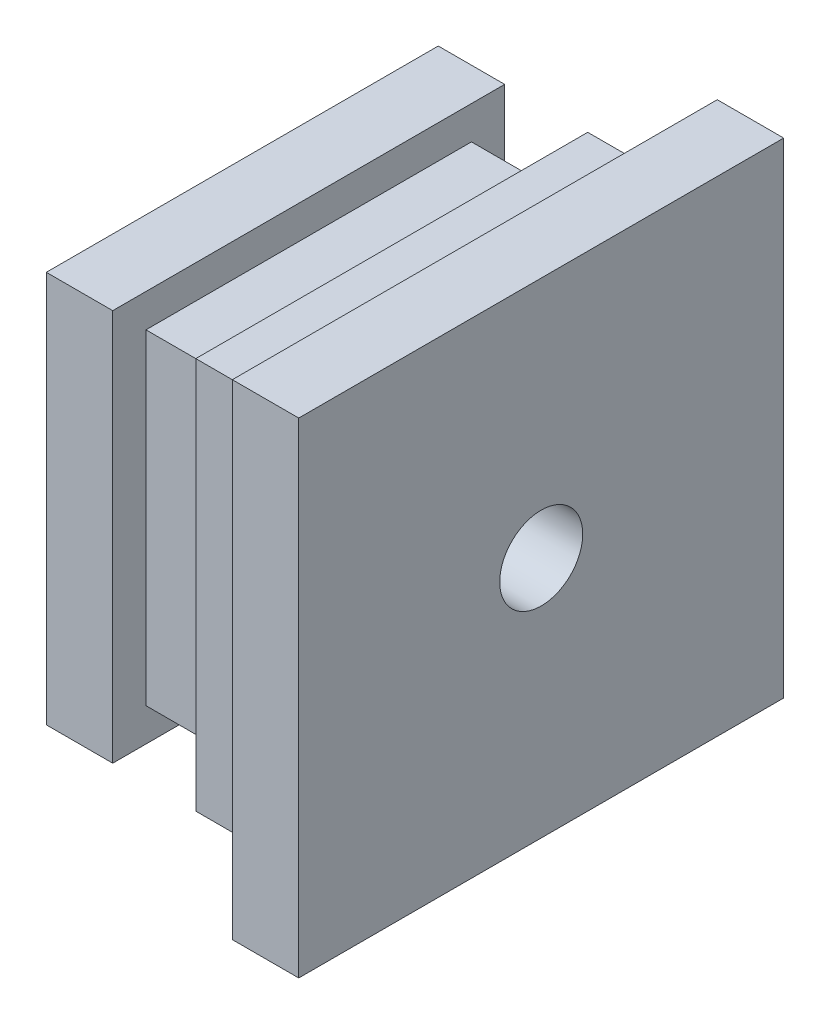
SolidWorks part; units mm, degrees
ref_plane "Спереди" through (0, 0, 0) normal (0, 0, 1) x (1, 0, 0)
ref_plane "Сверху" through (0, 0, 0) normal (0, 1, 0) x (1, 0, 0)
ref_plane "Справа" through (0, 0, 0) normal (1, 0, 0) x (0, 0, -1)
other "Configuration Table"
sketch "Эскиз1" plane through (0, 0, 0) normal (1, 0, 0) x (0, 0, -1)
  line L1 (-11.9614, 4.6852) -> (-0.1614, 4.6852)
  line L2 (-11.9614, 4.6852) -> (-11.9614, -7.1148)
  line L3 (-11.9614, -7.1148) -> (-0.1614, -7.1148)
  line L4 (-0.1614, 4.6852) -> (-0.1614, -7.1148)
  dimension "D1" = 11.8
  dimension "D2" = 11.8
extrude "Бобышка-Вытянуть1" add sketch "Эскиз1" along normal blind 8
sketch "Эскиз2" plane through (8, 0, 0) normal (1, 0, 0) x (0, 0, -1)
  line L0 (-13.3614, 6.0852) -> (-13.3614, -8.5148)
  line L1 (-13.3614, -8.5148) -> (1.2386, -8.5148)
  line L2 (1.2386, -8.5148) -> (1.2386, 6.0852)
  line L3 (1.2386, 6.0852) -> (-13.3614, 6.0852)
  line L4 (-11.9614, 4.6852) -> (-11.9614, -7.1148)
  line L5 (-11.9614, -7.1148) -> (-0.1614, -7.1148)
  line L6 (-0.1614, -7.1148) -> (-0.1614, 4.6852)
  line L7 (-0.1614, 4.6852) -> (-11.9614, 4.6852)
  line L8 (-11.9614, 4.6852) -> (-11.9614, -7.1148)
  line L9 (-11.9614, -7.1148) -> (-0.1614, -7.1148)
  line L10 (-0.1614, -7.1148) -> (-0.1614, 4.6852)
  line L11 (-0.1614, 4.6852) -> (-11.9614, 4.6852)
  dimension "D1" = 0
  dimension "D2" = 1.4
extrude "Бобышка-Вытянуть2" add sketch "Эскиз2" along normal blind 2 separate body contours M8 M5 M6 M7 | L2 L3 L0 L1 M5 M8 M7 M6
ref_plane "Плоскость1" through (5, 0, 0) normal (-1, 0, 0) x (0, 0, 1)
sketch "Эскиз4" plane through (5, 0, 0) normal (-1, 0, 0) x (0, 0, 1)
  line L4 (11.9614, -7.1148) -> (11.9614, 4.6852)
  line L5 (11.9614, 4.6852) -> (0.1614, 4.6852)
  line L6 (0.1614, 4.6852) -> (0.1614, -7.1148)
  line L7 (0.1614, -7.1148) -> (11.9614, -7.1148)
  line L8 (11.9614, -7.1148) -> (11.9614, 4.6852)
  line L9 (11.9614, 4.6852) -> (0.1614, 4.6852)
  line L10 (0.1614, 4.6852) -> (0.1614, -7.1148)
  line L11 (0.1614, -7.1148) -> (11.9614, -7.1148)
  line L16 (10.9614, -6.1148) -> (10.9614, 3.6852)
  line L17 (10.9614, 3.6852) -> (1.1614, 3.6852)
  line L18 (1.1614, 3.6852) -> (1.1614, -6.1148)
  line L19 (1.1614, -6.1148) -> (10.9614, -6.1148)
  line L20 (10.9614, -6.1148) -> (10.9614, 3.6852)
  line L21 (10.9614, 3.6852) -> (1.1614, 3.6852)
  line L22 (1.1614, 3.6852) -> (1.1614, -6.1148)
  line L23 (1.1614, -6.1148) -> (10.9614, -6.1148)
  dimension "D1" = 0
  dimension "D2" = 1
extrude "Вырез-Вытянуть1" cut sketch "Эскиз4" along normal blind 2 contours L10 L11 L8 L9 L23 L22 L21 L20
chamfer "Фаска1" distance 1 angle 45 4 edges at (0, -7.1148, 6.0614) (0, -1.2148, 11.9614) (0, -1.2148, 0.1614) (0, 4.6852, 6.0614)
chamfer "Фаска2" distance 0.5 angle 45 4 edges at (5, -1.2148, 11.9614) (5, -7.1148, 6.0614) (5, -1.2148, 0.1614) (5, 4.6852, 6.0614)
sketch "Эскиз5" plane through (10, 0, 0) normal (1, 0, 0) x (0, 0, -1)
  line L4 (1.2386, -8.5148) -> (1.2386, 6.0852)
  line L5 (1.2386, 6.0852) -> (-13.3614, 6.0852)
  line L6 (-13.3614, 6.0852) -> (-13.3614, -8.5148)
  line L7 (-13.3614, -8.5148) -> (1.2386, -8.5148)
  line L8 (1.2386, -8.5148) -> (1.2386, 6.0852)
  line L9 (1.2386, 6.0852) -> (-13.3614, 6.0852)
  line L10 (-13.3614, 6.0852) -> (-13.3614, -8.5148)
  line L11 (-13.3614, -8.5148) -> (1.2386, -8.5148)
  circle A0 centre (-6.0614, -1.2148) radius 7.3 construction
  circle A1 centre (-6.0614, -1.2148) radius 1.25
  dimension "D2" = 2.5
  dimension "D1" = 0
extrude "Вырез-Вытянуть2" cut sketch "Эскиз5" against normal blind 5 contours A1
